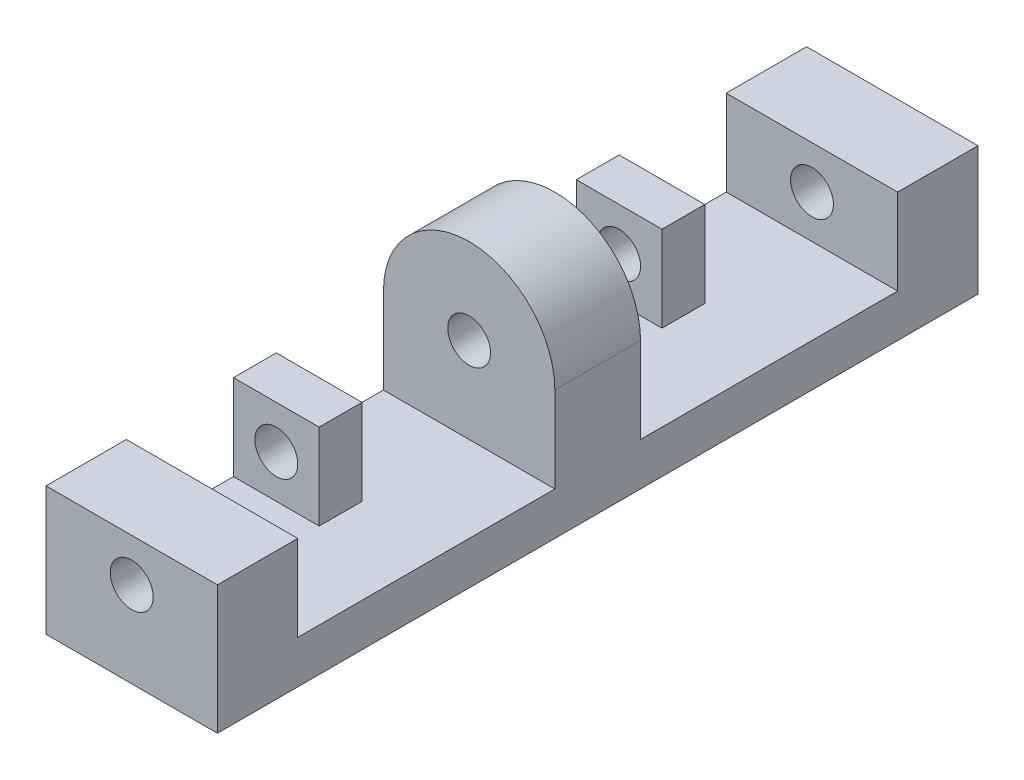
SolidWorks part; units mm, degrees
ref_plane "Front Plane" through (0, 0, 0) normal (0, 0, 1) x (1, 0, 0)
ref_plane "Top Plane" through (0, 0, 0) normal (0, 1, 0) x (1, 0, 0)
ref_plane "Right Plane" through (0, 0, 0) normal (1, 0, 0) x (0, 0, -1)
sketch "Sketch1" plane through (0, 0, 0) normal (0, 0, 1) x (1, 0, 0)
  line L1 (0, 0) -> (50.8, 0)
  line L2 (0, 0) -> (0, 38.1)
  line L3 (0, 38.1) -> (50.8, 38.1)
  line L4 (50.8, 0) -> (50.8, 38.1)
extrude "Extrude1" add sketch "Sketch1" along normal blind 225.425
ref_plane "Plane1" through (0, 0, 112.7125) normal (0, 0, 1) x (1, 0, 0)
sketch "Sketch3" plane through (50.8, 0, 0) normal (1, 0, 0) x (0, 0, -1)
  line L0 (-225.425, 38.1) -> (0, 38.1) construction
  line L1 (-201.6125, 38.1) -> (-23.8125, 38.1)
  line L2 (-201.6125, 38.1) -> (-201.6125, 12.7)
  line L3 (-201.6125, 12.7) -> (-23.8125, 12.7)
  line L4 (-23.8125, 38.1) -> (-23.8125, 12.7)
  line L5 (-112.7125, 27.94) -> (-112.7125, -27.94) construction
  dimension "D1" = 177.8
  dimension "D2" = 88.9
  dimension "D3" = 25.4
extrude "Cut-Extrude1" cut sketch "Sketch3" against normal through all
sketch "Sketch2" plane through (0, 0, 225.425) normal (0, 0, 1) x (1, 0, 0)
  line L0 (0, 38.1) -> (0, 0) construction
  line L4 (0, 0) -> (50.8, 0) construction
  circle A0 centre (25.4, 25.4) radius 6.35
  point P6 (25.4, 0)
extrude "Cut-Extrude2" cut sketch "Sketch2" against normal through all
sketch "Sketch4" plane through (0, 12.7, 0) normal (0, 1, 0) x (-1, 0, 0)
  line L0 (-108.5135, 112.7125) -> (46.7572, 112.7125) construction
  line L1 (0, 23.8125) -> (-50.8, 23.8125) construction
  line L3 (-50.8, 125.4125) -> (0, 125.4125)
  line L4 (-50.8, 100.0125) -> (-50.8, 125.4125)
  line L5 (-50.8, 100.0125) -> (0, 100.0125)
  line L6 (0, 100.0125) -> (0, 125.4125)
  line L7 (0, 201.6125) -> (0, 23.8125) construction
  line L8 (-50.8, 201.6125) -> (-50.8, 23.8125) construction
  dimension "D1" = 88.9
  dimension "D2" = 25.4
extrude "Extrude2" add sketch "Sketch4" along normal blind 50.8
sketch "Sketch5" plane through (0, 0, 125.4125) normal (0, 0, 1) x (1, 0, 0)
  line L5 (50.8, 63.5) -> (50.8, 12.7) construction
  line L6 (0, 63.5) -> (50.8, 63.5) construction
  circle A0 centre (25.4, 38.1) radius 6.35
extrude "Cut-Extrude3" cut sketch "Sketch5" against normal up to next
sketch "Sketch6" plane through (0, 0, 100.0125) normal (0, 0, -1) x (-1, 0, 0)
  line L4 (-50.8, 12.7) -> (0, 12.7)
  line L5 (0, 12.7) -> (0, 63.5)
  line L6 (0, 63.5) -> (-50.8, 63.5)
  line L7 (-50.8, 63.5) -> (-50.8, 12.7)
  line L9 (0, 12.7) -> (0, 38.1) construction
  line L10 (-25.4, 63.5) -> (-50.8, 63.5) construction
  line L11 (-50.8, 63.5) -> (-50.8, 38.1) construction
  arc A0 (0, 38.1) -> (-50.8, 38.1) centre (-25.4, 38.1) ccw
  dimension "D1" = 0
extrude "Cut-Extrude4" cut sketch "Sketch6" against normal through all and the other way through all flip side to cut
sketch "Sketch7" plane through (0, 0, 0) normal (-1, 0, 0) x (0, 0, 1)
  line L0 (225.425, 0) -> (0, 0) construction
  line L1 (55.5625, 38.1) -> (68.2625, 38.1)
  line L2 (55.5625, 38.1) -> (55.5625, 12.7)
  line L3 (55.5625, 12.7) -> (68.2625, 12.7)
  line L4 (68.2625, 38.1) -> (68.2625, 12.7)
  line L5 (55.5625, 38.1) -> (68.2625, 12.7) construction
  line L6 (55.5625, 12.7) -> (68.2625, 38.1) construction
  line L7 (112.7125, -27.94) -> (112.7125, 27.94) construction
  line L8 (100.0125, 12.7) -> (23.8125, 12.7) construction
  point P0 (61.9125, 25.4)
  dimension "D1" = 12.7
  dimension "D2" = 25.4
  dimension "D3" = 50.8
extrude "Boss-Extrude1" add sketch "Sketch7" against normal blind 25.4 contours L2 L3 L4 L1
sketch "Sketch8" plane through (0, 0, 55.5625) normal (0, 0, -1) x (-1, 0, 0)
  line L0 (0, 38.1) -> (0, 12.7) construction
  line L2 (0, 0) -> (-50.8, 0) construction
  circle A0 centre (-12.7, 25.4) radius 6.35
  dimension "D3" = 12.7
  dimension "D1" = 12.7
  dimension "D2" = 25.4
extrude "Cut-Extrude5" cut sketch "Sketch8" against normal up to surface (12.7 mm away)
mirror "Mirror1" about plane through (0, 0, 112.7125) normal (0, 0, 1) of "Boss-Extrude1", "Cut-Extrude5"
equation "\"D1@Sketch2\" = \"D1@Sketch1\" / 2"
equation "\"D2@Sketch5\" = \"D1@Sketch1\" / 2"
